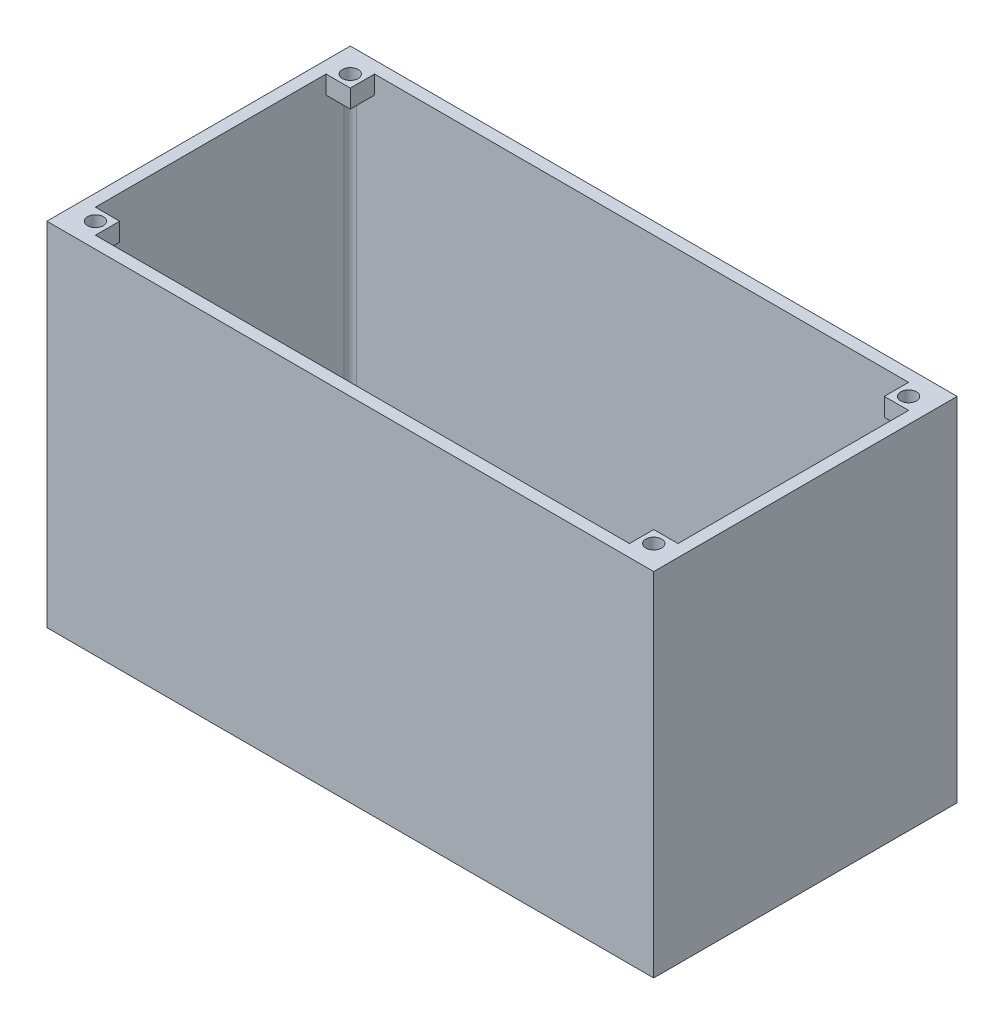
SolidWorks part; units mm, degrees
ref_plane "Front Plane" through (0, 0, 0) normal (0, 0, 1) x (1, 0, 0)
ref_plane "Top Plane" through (0, 0, 0) normal (0, 1, 0) x (1, 0, 0)
ref_plane "Right Plane" through (0, 0, 0) normal (1, 0, 0) x (0, 0, -1)
sketch "Sketch1" plane through (0, 0, 0) normal (0, 1, 0) x (1, 0, 0)
  line L1 (0, 0) -> (127, 0)
  line L2 (0, 0) -> (0, 63.5)
  line L3 (0, 63.5) -> (127, 63.5)
  line L4 (127, 0) -> (127, 63.5)
extrude "Boss-Extrude1" add sketch "Sketch1" against normal blind 302.26
sketch "Sketch2" plane through (0, -302.26, 0) normal (0, -1, 0) x (1, 0, 0)
  line L0 (0, -63.5) -> (0, -60.96)
  line L1 (0, -63.5) -> (0, 0) construction
  line L2 (0, -60.96) -> (2.54, -60.96)
  line L3 (127, 0) -> (127, -2.54)
  line L4 (127, 0) -> (127, -63.5) construction
  line L5 (127, -2.54) -> (124.46, -2.54)
  line L7 (2.54, -60.96) -> (124.46, -60.96)
  line L8 (2.54, -60.96) -> (2.54, -2.54)
  line L9 (2.54, -2.54) -> (124.46, -2.54)
  line L10 (124.46, -60.96) -> (124.46, -2.54)
extrude "Cut-Extrude1" cut sketch "Sketch2" against normal blind 299.72 contours L7 L10 L9 L8
fillet "Fillet3" radius 1.27 1 edges at (2.54, -152.4, -60.96)
fillet "Fillet4" radius 1.27 1 edges at (2.54, -152.4, -2.54)
fillet "Fillet5" radius 1.27 1 edges at (124.46, -152.4, -2.54)
fillet "Fillet6" radius 1.27 1 edges at (124.46, -152.4, -60.96)
sketch "Sketch3" plane through (0, 0, 0) normal (-1, 0, 0) x (0, 0, 1)
  line L0 (-63.5, -302.26) -> (-31.75, -302.26)
  line L1 (-63.5, -302.26) -> (0, -302.26) construction
  line L2 (-31.75, -302.26) -> (-31.75, -152.4)
  circle A0 centre (-31.75, -152.4) radius 12.7
extrude "Cut-Extrude3" cut sketch "Sketch3" against normal blind 254
sketch "Sketch4" plane through (0, 0, 0) normal (0, 1, 0) x (1, 0, 0)
  line L1 (0, 0) -> (127, 0)
  line L2 (0, 0) -> (0, 63.5)
  line L3 (0, 63.5) -> (127, 63.5)
  line L4 (127, 0) -> (127, 63.5)
extrude "Cut-Extrude4" cut sketch "Sketch4" against normal blind 2.54
sketch "Sketch5" plane through (0, 0, 0) normal (0, 0, 1) x (1, 0, 0)
  line L0 (0, -2.54) -> (13.5, -2.54)
  line L1 (0, -2.54) -> (127, -2.54) construction
  line L2 (13.5, -2.54) -> (13.5, -25.4)
  line L3 (127, -2.54) -> (113.5, -2.54)
  line L4 (113.5, -2.54) -> (113.5, -25.4)
  line L5 (13.5, -25.4) -> (113.5, -25.4)
  line L6 (13.5, -25.4) -> (13.5, -190.4)
  line L7 (113.5, -25.4) -> (113.5, -190.4)
  line L8 (113.5, -190.4) -> (13.5, -190.4)
extrude "Cut-Extrude5" cut sketch "Sketch5" against normal blind 25.4 and the other way blind 8.128 contours L8 L7 L5 L6
sketch "Sketch6" plane through (0, 0, -2.54) normal (0, 0, -1) x (-1, 0, 0)
  line L3 (-11.576, -17.86) -> (-9.036, -17.86)
  line L4 (-9.036, -17.86) -> (-9.036, -22.94)
  line L6 (-9.036, -22.94) -> (-14.116, -22.94)
  line L8 (-14.116, -22.94) -> (-14.116, -17.86)
  line L9 (-14.116, -17.86) -> (-11.576, -17.86)
  circle A0 centre (-11.576, -20.4) radius 1.6
extrude "Boss-Extrude3" add sketch "Sketch6" along normal blind 8 contours L3 L4 L6 L8 L9 | A0
sketch "Sketch8" plane through (0, 0, -2.54) normal (0, 0, -1) x (-1, 0, 0)
  line L0 (-113.5, -25.4) -> (-112.884, -25.4)
  line L1 (-13.5, -25.4) -> (-113.5, -25.4) construction
  line L2 (-112.884, -25.4) -> (-112.884, -22.94)
  line L3 (-112.884, -17.86) -> (-117.964, -22.94)
  line L4 (-112.884, -22.94) -> (-117.964, -22.94)
  line L5 (-112.884, -22.94) -> (-112.884, -17.86)
  line L6 (-112.884, -17.86) -> (-117.964, -17.86)
  line L7 (-117.964, -22.94) -> (-117.964, -17.86)
  line L8 (-117.964, -17.86) -> (-112.884, -22.94)
  circle A0 centre (-115.424, -20.4) radius 1.6
extrude "Boss-Extrude4" add sketch "Sketch8" along normal blind 8 contours A0 L8 L7 L3 | A0 L3 L6 L8 | A0 L8 L5 L3 | A0 L3 L4 L8
sketch "Sketch10" plane through (0, 0, -2.54) normal (0, 0, -1) x (-1, 0, 0)
  line L0 (-113.5, -190.4) -> (-112.884, -190.4)
  line L1 (-113.5, -190.4) -> (-13.5, -190.4) construction
  line L2 (-112.884, -190.4) -> (-112.884, -192.86)
  line L3 (-117.964, -192.86) -> (-112.884, -197.94)
  line L4 (-112.884, -192.86) -> (-117.964, -192.86)
  line L5 (-112.884, -192.86) -> (-112.884, -197.94)
  line L6 (-112.884, -197.94) -> (-117.964, -197.94)
  line L7 (-117.964, -192.86) -> (-117.964, -197.94)
  line L8 (-112.884, -192.86) -> (-117.964, -197.94)
  circle A0 centre (-115.424, -195.4) radius 1.6
extrude "Boss-Extrude5" add sketch "Sketch10" along normal blind 8 contours A0 L3 L7 L8 | A0 L8 L4 L3 | A0 L3 L5 L8 | A0 L8 L6 L3
sketch "Sketch11" plane through (0, 0, -2.54) normal (0, 0, -1) x (-1, 0, 0)
  line L0 (-13.5, -190.4) -> (-14.116, -190.4)
  line L1 (-113.5, -190.4) -> (-13.5, -190.4) construction
  line L2 (-14.116, -190.4) -> (-14.116, -192.86)
  line L3 (-14.116, -192.86) -> (-9.036, -197.94)
  line L4 (-14.116, -192.86) -> (-9.036, -192.86)
  line L5 (-14.116, -192.86) -> (-14.116, -197.94)
  line L6 (-14.116, -197.94) -> (-9.036, -197.94)
  line L7 (-9.036, -192.86) -> (-9.036, -197.94)
  line L8 (-14.116, -197.94) -> (-9.036, -192.86)
  circle A0 centre (-11.576, -195.4) radius 1.6
extrude "Boss-Extrude6" add sketch "Sketch11" along normal blind 8 contours A0 L3 L5 L8 | A0 L8 L4 L3 | A0 L3 L7 L8 | A0 L8 L6 L3
sketch "Sketch12" plane through (0, -2.54, 0) normal (0, 1, 0) x (1, 0, 0)
  line L1 (0, 63.5) -> (127, 63.5)
  line L2 (0, 63.5) -> (0, 0)
  line L3 (0, 0) -> (127, 0)
  line L4 (127, 63.5) -> (127, 0)
extrude "Cut-Extrude6" cut sketch "Sketch12" against normal blind 226.06
sketch "Sketch13" plane through (0, -228.6, 0) normal (0, 1, 0) x (1, 0, 0)
  line L0 (3.81, 2.54) -> (2.54, 2.54)
  line L1 (2.54, 2.54) -> (2.54, 3.81)
  line L2 (3.81, 60.96) -> (2.54, 60.96)
  line L3 (2.54, 60.96) -> (2.54, 59.69)
  line L4 (123.19, 60.96) -> (124.46, 60.96)
  line L5 (124.46, 59.69) -> (124.46, 60.96)
  line L6 (123.19, 2.54) -> (124.46, 2.54)
  line L7 (124.46, 2.54) -> (124.46, 3.81)
  line L8 (124.46, 59.69) -> (124.46, 3.81) construction
  line L9 (119.38, 60.96) -> (124.46, 55.88)
  line L10 (2.54, 60.96) -> (7.62, 60.96)
  line L11 (2.54, 60.96) -> (2.54, 55.88)
  line L12 (2.54, 55.88) -> (7.62, 55.88)
  line L13 (7.62, 60.96) -> (7.62, 55.88)
  line L14 (124.46, 60.96) -> (119.38, 60.96)
  line L15 (124.46, 60.96) -> (124.46, 55.88)
  line L16 (124.46, 55.88) -> (119.38, 55.88)
  line L17 (119.38, 60.96) -> (119.38, 55.88)
  line L18 (124.46, 2.54) -> (119.38, 2.54)
  line L19 (124.46, 2.54) -> (124.46, 7.62)
  line L20 (124.46, 7.62) -> (119.38, 7.62)
  line L21 (119.38, 2.54) -> (119.38, 7.62)
  line L22 (2.54, 2.54) -> (7.62, 2.54)
  line L23 (2.54, 2.54) -> (2.54, 7.62)
  line L24 (2.54, 7.62) -> (7.62, 7.62)
  line L25 (7.62, 2.54) -> (7.62, 7.62)
  line L26 (119.38, 55.88) -> (124.46, 60.96)
  arc A0 (123.19, 2.54) -> (124.46, 3.81) centre (123.19, 3.81) ccw construction
  circle A1 centre (5.08, 58.42) radius 1.651
  circle A2 centre (121.92, 58.42) radius 1.651
  circle A3 centre (121.92, 5.08) radius 1.651
  circle A4 centre (5.08, 5.08) radius 1.651
extrude "Boss-Extrude7" add sketch "Sketch13" against normal blind 3.81 contours L21 L20 A3 M32 M31 M30 | A2 L9 L17 L26 | A2 L26 L9 M29 M28 | A2 L9 L26 M30 M29 | A2 L26 L16 L9 | L25 L24 A4 M32 M26 M25 | L13 L12 A1 M28 M27 M26
